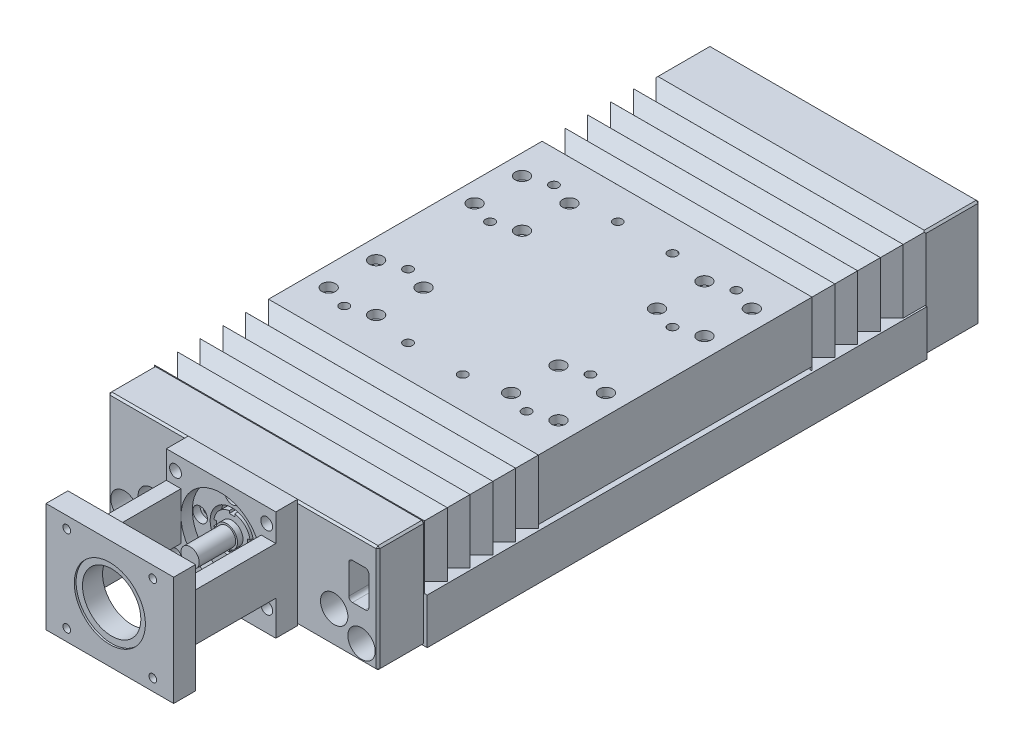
SolidWorks part; units mm, degrees
ref_plane "前视基准面" through (0, 0, 0) normal (0, 0, 1) x (1, 0, 0)
ref_plane "上视基准面" through (0, 0, 0) normal (0, 1, 0) x (1, 0, 0)
ref_plane "右视基准面" through (0, 0, 0) normal (1, 0, 0) x (0, 0, -1)
sketch "草图1" plane through (0, 0, 0) normal (0, 0, 1) x (1, 0, 0)
  line L0 (37.5, 30) -> (42.5, 30)
  line L1 (-75, 0) -> (75, 0)
  line L2 (-75, 0) -> (-75, 25)
  line L3 (-42.5, 30) -> (-37.5, 30)
  line L4 (75, 0) -> (75, 25)
  line L6 (-37.5, 30) -> (-37.5, 16)
  line L7 (-34.5, 13) -> (34.5, 13)
  line L8 (37.5, 30) -> (37.5, 16)
  line L10 (-42.5, 30) -> (-42.5, 28)
  line L11 (-42.5, 28) -> (-50, 28)
  line L12 (42.5, 30) -> (42.5, 28)
  line L13 (42.5, 28) -> (50, 28)
  line L14 (-50, 28) -> (-50, 25)
  line L15 (-50, 25) -> (-75, 25)
  line L18 (50, 28) -> (50, 25)
  line L19 (50, 25) -> (75, 25)
  arc A0 (37.5, 16) -> (34.5, 13) centre (34.5, 16) cw
  arc A1 (-37.5, 16) -> (-34.5, 13) centre (-34.5, 16) ccw
  point P0 (-75, 0)
  point P3 (75, 0)
  point P12 (37.5, 13)
  point P22 (-37.5, 13)
  dimension "D11" = 3
  dimension "D1" = 150
  dimension "D2" = 13
  dimension "D3" = 75
  dimension "D4" = 85
  dimension "D5" = 100
  dimension "D6" = 30
  dimension "D7" = 75
  dimension "D9" = 25
  dimension "D10" = 28
extrude "凸台-拉伸1" add sketch "草图1" along normal mid plane 274
ref_plane "基准面1" through (0, 0, 137) normal (0, 0, 1) x (1, 0, 0)
sketch "草图3" plane through (0, 0, 137) normal (0, 0, 1) x (1, 0, 0)
  line L1 (-74, 60) -> (74, 60)
  line L2 (-74, 60) -> (-74, 1)
  line L3 (-74, 1) -> (74, 1)
  line L4 (74, 60) -> (74, 1)
  dimension "D1" = 148
  dimension "D2" = 59
  dimension "D3" = 74
  dimension "D4" = 1
extrude "凸台-拉伸2" add sketch "草图3" along normal blind 26 separate body
ref_plane "基准面2" through (0, 0, -137) normal (0, 0, -1) x (-1, 0, 0)
sketch "草图4" plane through (0, 0, -137) normal (0, 0, -1) x (-1, 0, 0)
  line L1 (-74, 1) -> (74, 1)
  line L2 (-74, 1) -> (-74, 60)
  line L3 (-74, 60) -> (74, 60)
  line L4 (74, 1) -> (74, 60)
extrude "凸台-拉伸3" add sketch "草图4" along normal blind 30
sketch "草图5" plane through (0, 0, 163) normal (0, 0, 1) x (1, 0, 0)
  circle A0 centre (0, 33) radius 10
  dimension "D1" = 20
  dimension "D2" = 33
extrude "切除-拉伸1" cut sketch "草图5" against normal up to next
sketch "草图6" plane through (0, 0, 163) normal (0, 0, 1) x (1, 0, 0)
  circle A0 centre (0, 33) radius 14
  dimension "D1" = 28
extrude "切除-拉伸2" cut sketch "草图6" against normal blind 18
sketch "草图7" plane through (0, 0, -167) normal (0, 0, -1) x (-1, 0, 0)
  circle A0 centre (0, 33) radius 13
  dimension "D2" = 26
  dimension "D1" = 33
extrude "切除-拉伸3" cut sketch "草图7" against normal up to next
sketch "草图8" plane through (0, 0, 0) normal (0, 0, 1) x (1, 0, 0)
  line L0 (-20, 44) -> (-20, 24)
  line L1 (-74, 60) -> (74, 60)
  line L2 (-74, 60) -> (-74, 27)
  line L3 (-10, 14) -> (10, 14)
  line L4 (74, 60) -> (74, 27)
  line L5 (-20, 44) -> (-33, 44)
  line L6 (20, 44) -> (20, 33)
  line L7 (-33, 44) -> (-33, 52)
  line L8 (-33, 52) -> (-67, 52)
  line L9 (-67, 52) -> (-67, 44)
  line L10 (-67, 44) -> (-69, 44)
  line L11 (-69, 44) -> (-69, 27)
  line L12 (20, 33) -> (17, 33)
  line L13 (-69, 27) -> (-74, 27)
  line L14 (20, 44) -> (33, 44)
  line L15 (17, 33) -> (17, 21)
  line L16 (33, 44) -> (33, 52)
  line L17 (33, 52) -> (67, 52)
  line L18 (67, 52) -> (67, 44)
  line L19 (67, 44) -> (69, 44)
  line L20 (69, 44) -> (69, 27)
  line L21 (69, 27) -> (74, 27)
  line L22 (-20, 24) -> (-10, 14)
  line L23 (10, 14) -> (17, 21)
  circle A0 centre (0, 33) radius 10
  point P9 (-20, 14)
  point P12 (17, 14)
  dimension "D1" = 20
  dimension "D2" = 27
  dimension "D3" = 148
  dimension "D4" = 74
  dimension "D5" = 33
  dimension "D6" = 40
  dimension "D7" = 20
  dimension "D8" = 46
  dimension "D9" = 3
  dimension "D10" = 138
  dimension "D11" = 69
  dimension "D12" = 33
  dimension "D13" = 66
  dimension "D14" = 33
  dimension "D15" = 34
  dimension "D16" = 34
  dimension "D17" = 8
  dimension "D18" = 16
  dimension "D19" = 16
  dimension "D20" = 27
  dimension "D23" = 10
  dimension "D24" = 7
extrude "凸台-拉伸4" add sketch "草图8" along normal mid plane 150 separate body
sketch "草图9" plane through (0, 0, -75) normal (0, 0, -1) x (-1, 0, 0)
  line L1 (-33, 44) -> (30.2224, 44)
  line L2 (-33, 44) -> (-33, 7.4314)
  line L3 (-33, 7.4314) -> (30.2224, 7.4314)
  line L4 (30.2224, 44) -> (30.2224, 7.4314)
extrude "切除-拉伸4" cut sketch "草图9" against normal blind 60
sketch "草图10" plane through (0, 0, 75) normal (0, 0, 1) x (1, 0, 0)
  circle A0 centre (0, 33) radius 14
  dimension "D1" = 28
extrude "切除-拉伸5" cut sketch "草图10" against normal blind 50
hole_wizard "M6 螺纹孔1" positions "草图12" profile "草图11" tap size "M6" standard "GB"
sketch "草图12" plane through (0, 60, 0) normal (0, 1, 0) x (-1, 0, 0)
  point P0 (50, -57.5)
  point P1 (15, -57.5)
  point P3 (-15, -57.5)
  point P5 (-50, -57.5)
  point P7 (50, -22.5)
  point P9 (50, 22.5)
  point P11 (50, 57.5)
  point P17 (15, 57.5)
  point P23 (-15, 57.5)
  point P25 (-50, -22.5)
  point P27 (-50, 22.5)
  point P29 (-50, 57.5)
  dimension "D1" = 45
  dimension "D2" = 35
  dimension "D3" = 35
  dimension "D4" = 22.5
  dimension "D5" = 30
  dimension "D6" = 35
  dimension "D7" = 35
  dimension "D8" = 15
sketch "草图11" plane through (-50, 60, -57.5) normal (1, 0, 0) x (0, 0, 1)
  line L0 (0, 0) -> (0, 12.5022)
  line L1 (0, 12.5022) -> (2.5, 11)
  line L2 (2.5, 11) -> (2.5, 0)
  line L5 (2.5, 0) -> (0, 0)
  line L10 (0, 12.5022) -> (-2.5, 11) construction
  line L11 (0, -6.35) -> (0, 107.95) construction
  dimension "螺纹孔钻头直径" = 5
  dimension "螺纹孔钻头深度" = 11
  dimension "导头角度" = 118
hole_wizard "孔1" positions "草图15" profile "草图14" legacy
sketch "草图15" plane through (0, 60, 0) normal (0, 1, 0) x (-1, 0, 0)
  point P0 (-63, -53)
  point P1 (-63, -27)
  point P3 (-37, -53)
  point P5 (-37, -27)
  point P7 (-63, 27)
  point P9 (-63, 53)
  point P11 (-37, 27)
  point P13 (-37, 53)
  point P15 (63, 53)
  point P17 (63, 27)
  point P19 (37, 27)
  point P21 (37, 53)
  point P23 (63, -27)
  point P25 (63, -53)
  point P27 (37, -53)
  point P29 (37, -27)
  dimension "D1" = 26
  dimension "D2" = 26
  dimension "D3" = 26
  dimension "D4" = 26
  dimension "D5" = 54
  dimension "D6" = 27
  dimension "D7" = 74
  dimension "D8" = 37
sketch "草图14" plane through (63, 60, -53) normal (1, 0, 0) x (0, 0, 1)
  line L0 (0, 0) -> (0, 100)
  line L1 (0, 100) -> (2.25, 100)
  line L2 (2.25, 100) -> (2.25, 4.5)
  line L3 (2.25, 4.5) -> (3.75, 4.5)
  line L4 (3.75, 4.5) -> (3.75, 0)
  line L5 (3.75, 0) -> (0, 0)
  line L6 (0, 110) -> (0, -10) construction
  dimension "直径" = 4.5
  dimension "深度" = 100
  dimension "柱坑直径" = 7.5
  dimension "柱坑深度" = 4.5
ref_plane "基准面3" through (0, 33, 0) normal (0, 1, 0) x (-1, 0, 0)
sketch "草图17" plane through (0, 0, 163) normal (0, 0, 1) x (1, 0, 0)
  line L0 (58, 37) -> (69, 37) construction
  line L1 (60, 47) -> (67, 47)
  line L2 (58, 45) -> (58, 29)
  line L3 (60, 27) -> (67, 27)
  line L4 (69, 45) -> (69, 29)
  line L5 (-74, 1) -> (74, 1) construction
  line L6 (63.5, 47) -> (63.5, 27) construction
  arc A0 (69, 29) -> (67, 27) centre (67, 29) cw
  arc A1 (60, 27) -> (58, 29) centre (60, 29) cw
  arc A2 (58, 45) -> (60, 47) centre (60, 45) cw
  arc A3 (67, 47) -> (69, 45) centre (67, 45) cw
  point P14 (69, 27)
  point P17 (58, 27)
  point P22 (69, 47)
  dimension "D5" = 2
  dimension "D1" = 11
  dimension "D2" = 20
  dimension "D3" = 36
  dimension "D4" = 63.5
extrude "切除-拉伸6" cut sketch "草图17" against normal up to next
sketch "草图18" plane through (0, 0, 137) normal (0, 0, -1) x (-1, 0, 0)
  line L0 (-74, 1) -> (-74, 60) construction
  line L1 (-67, 47) -> (-34.5, 47)
  line L2 (-69, 45) -> (-69, 29)
  line L3 (-67, 27) -> (-34.5, 27)
  line L4 (-32.5, 45) -> (-32.5, 29)
  line L5 (-74, 60) -> (74, 60) construction
  arc A0 (-67, 27) -> (-69, 29) centre (-67, 29) cw
  arc A1 (-67, 47) -> (-69, 45) centre (-67, 45) ccw
  arc A2 (-34.5, 27) -> (-32.5, 29) centre (-34.5, 29) ccw
  arc A3 (-32.5, 45) -> (-34.5, 47) centre (-34.5, 45) ccw
  point P10 (-69, 27)
  point P13 (-69, 47)
  point P18 (-32.5, 47)
  dimension "D5" = 2
  dimension "D6" = 2
  dimension "D1" = 20
  dimension "D2" = 5
  dimension "D3" = 13
  dimension "D4" = 36.5
extrude "切除-拉伸7" cut sketch "草图18" against normal blind 10
hole_wizard "M6 螺纹孔2" positions "草图20" profile "草图19" tap size "M6" standard "GB"
sketch "草图20" plane through (0, 0, 163) normal (0, 0, 1) x (1, 0, 0)
  line L0 (-74, 1) -> (74, 1) construction
  point P0 (-25, 53)
  point P1 (25, 53)
  point P3 (-25, 13)
  point P5 (25, 13)
  dimension "D1" = 40
  dimension "D2" = 50
  dimension "D3" = 25
  dimension "D4" = 52
sketch "草图19" plane through (-25, 53, 163) normal (1, 0, 0) x (0, -1, 0)
  line L0 (0, 0) -> (0, 16.5022)
  line L1 (0, 16.5022) -> (2.5, 15)
  line L2 (2.5, 15) -> (2.5, 0)
  line L5 (2.5, 0) -> (0, 0)
  line L10 (0, 16.5022) -> (-2.5, 15) construction
  line L11 (0, -6.35) -> (0, 107.95) construction
  dimension "螺纹孔钻头直径" = 5
  dimension "螺纹孔钻头深度" = 15
  dimension "导头角度" = 118
chamfer "倒角1" distance 1 angle 45 12 edges at (0, 1, 137) (74, 30.5, 137) (74, 1, 150) (0, 1, 163) (74, 30.5, 163) (74, 60, 150) (0, 60, 137) (-74, 1, 150) (-74, 30.5, 137) (-74, 30.5, 163) (-74, 60, 150) (0, 60, 163)
hole_wizard "孔2" positions "草图23" profile "草图22" legacy
sketch "草图23" plane through (0, 0, 163) normal (0, 0, 1) x (1, 0, 0)
  line L0 (73, 1) -> (-73, 1) construction
  point P0 (-65, 10)
  point P1 (-50, 19)
  point P3 (50, 19)
  point P5 (65, 10)
  dimension "D1" = 130
  dimension "D2" = 65
  dimension "D3" = 100
  dimension "D4" = 50
  dimension "D5" = 9
  dimension "D6" = 18
sketch "草图22" plane through (-65, 10, 163) normal (1, 0, 0) x (0, -1, 0)
  line L0 (0, 0) -> (0, 100)
  line L1 (0, 100) -> (4.5, 100)
  line L2 (4.5, 100) -> (4.5, 16)
  line L3 (4.5, 16) -> (7.5, 16)
  line L4 (7.5, 16) -> (7.5, 0)
  line L5 (7.5, 0) -> (0, 0)
  line L6 (0, 110) -> (0, -10) construction
  dimension "直径" = 9
  dimension "深度" = 100
  dimension "柱坑直径" = 15
  dimension "柱坑深度" = 16
hole_wizard "孔3" positions "草图26" profile "草图25" legacy
sketch "草图26" plane through (0, 0, -167) normal (0, 0, -1) x (-1, 0, 0)
  line L0 (-74, 1) -> (74, 1) construction
  point P0 (-65, 10)
  point P1 (-50, 19)
  point P3 (65, 10)
  point P5 (50, 19)
  dimension "D1" = 100
  dimension "D2" = 130
  dimension "D3" = 50
  dimension "D4" = 65
  dimension "D5" = 9
  dimension "D6" = 18
sketch "草图25" plane through (65, 10, -167) normal (1, 0, 0) x (0, 1, 0)
  line L0 (0, 0) -> (0, 100)
  line L1 (0, 100) -> (4.5, 100)
  line L2 (4.5, 100) -> (4.5, 16)
  line L3 (4.5, 16) -> (7.5, 16)
  line L4 (7.5, 16) -> (7.5, 0)
  line L5 (7.5, 0) -> (0, 0)
  line L6 (0, 110) -> (0, -10) construction
  dimension "直径" = 9
  dimension "深度" = 100
  dimension "柱坑直径" = 15
  dimension "柱坑深度" = 16
sketch "草图28" plane through (0, 0, 163) normal (0, 0, 1) x (1, 0, 0)
  line L0 (82.5, 33) -> (-82.5, 33) construction
  line L1 (-30, 61) -> (30, 61)
  line L2 (-30, 61) -> (-30, 1)
  line L3 (-30, 1) -> (30, 1)
  line L4 (30, 61) -> (30, 1)
  circle A0 centre (0, 33) radius 22
  circle A1 centre (-25, 53) radius 3.25
  circle A2 centre (25, 53) radius 3.25
  circle A3 centre (25, 13) radius 3.25
  circle A4 centre (-25, 13) radius 3.25
  dimension "D5" = 44
  dimension "D6" = 6.5
  dimension "D1" = 60
  dimension "D2" = 60
  dimension "D3" = 28
  dimension "D4" = 30
extrude "凸台-拉伸5" add sketch "草图28" along normal blind 12
sketch "草图29" plane through (0, 0, 175) normal (0, 0, 1) x (1, 0, 0)
  line L0 (-30, 59) -> (-30, 2) construction
  line L1 (-30, 46) -> (-22, 46)
  line L2 (-30, 46) -> (-30, 20)
  line L3 (-30, 20) -> (-22, 20)
  line L4 (-22, 46) -> (-22, 20)
  line L5 (30, 1) -> (30, 61) construction
  line L6 (30, 46) -> (22, 46)
  line L7 (30, 46) -> (30, 20)
  line L8 (30, 20) -> (22, 20)
  line L9 (22, 46) -> (22, 20)
  line L10 (82.5, 33) -> (-82.5, 33) construction
  dimension "D1" = 26
  dimension "D2" = 13
  dimension "D3" = 8
  dimension "D4" = 8
extrude "凸台-拉伸6" add sketch "草图29" along normal blind 49
sketch "草图30" plane through (0, 0, 224) normal (0, 0, 1) x (1, 0, 0)
  line L0 (82.5, 33) -> (-82.5, 33) construction
  line L1 (-35, 63) -> (35, 63)
  line L2 (-35, 63) -> (-35, 3)
  line L3 (-35, 3) -> (35, 3)
  line L4 (35, 63) -> (35, 3)
  circle A0 centre (0, 33) radius 16
  dimension "D5" = 32
  dimension "D1" = 60
  dimension "D2" = 30
  dimension "D3" = 70
  dimension "D4" = 35
extrude "凸台-拉伸7" add sketch "草图30" along normal blind 12
hole_wizard "M5 螺纹孔1" positions "草图32" profile "草图31" tap size "M5" standard "GB"
sketch "草图32" plane through (0, 0, 236) normal (0, 0, 1) x (1, 0, 0)
  line L0 (82.5, 33) -> (-82.5, 33) construction
  point P0 (-23.6, 56.6)
  point P1 (-23.6, 9.4)
  point P3 (23.6, 9.4)
  point P5 (23.6, 56.6)
  dimension "D1" = 47.2
  dimension "D2" = 47.2
  dimension "D3" = 23.6
  dimension "D4" = 23.6
sketch "草图31" plane through (-23.6, 56.6, 236) normal (1, 0, 0) x (0, -1, 0)
  line L0 (0, 0) -> (0, 13.6618)
  line L1 (0, 13.6618) -> (2.1, 12.4)
  line L2 (2.1, 12.4) -> (2.1, 0)
  line L5 (2.1, 0) -> (0, 0)
  line L10 (0, 13.6618) -> (-2.1, 12.4) construction
  line L11 (0, -6.35) -> (0, 107.95) construction
  dimension "螺纹孔钻头直径" = 4.2
  dimension "螺纹孔钻头深度" = 12.4
  dimension "导头角度" = 118
sketch "草图33" plane through (0, 0, 236) normal (0, 0, 1) x (1, 0, 0)
  circle A0 centre (0, 33) radius 19.5
  dimension "D1" = 39
extrude "切除-拉伸8" cut sketch "草图33" against normal blind 1
sketch "草图34" plane through (0, 0, 0) normal (0, 0, 1) x (1, 0, 0)
  line L1 (-50, 25) -> (-65, 25)
  line L2 (-50, 25) -> (-50, 40)
  line L3 (-50, 40) -> (-65, 40)
  line L4 (-65, 25) -> (-65, 40)
  line L5 (50, 25) -> (65, 25)
  line L6 (50, 25) -> (50, 40)
  line L7 (50, 40) -> (65, 40)
  line L8 (65, 25) -> (65, 40)
  dimension "D1" = 15
  dimension "D2" = 15
  dimension "D3" = 15
extrude "凸台-拉伸8" add sketch "草图34" against normal up to surface (137 mm away) separate body
mirror "镜向2" about plane through (0, 0, 0) normal (0, 0, 1) of "凸台-拉伸8"
sketch "草图35" plane through (0, 0, 0) normal (1, 0, 0) x (0, 0, -1)
  line L0 (75, 60) -> (81.25, 53.7545)
  line L1 (81.25, 53.7545) -> (87.5, 60.0091)
  line L2 (75, 60) -> (75, 59)
  line L3 (75, 27) -> (75, 60) construction
  line L4 (75, 59) -> (81.25, 52.7545)
  line L5 (81.25, 52.7545) -> (87.5, 59.0091)
  line L6 (87.5, 59.0091) -> (87.5, 60.0091)
  dimension "D1" = 12.5
  dimension "D2" = 1
  dimension "D3" = 6.2545
  dimension "D4" = 7.2455
extrude "凸台-拉伸9" add sketch "草图35" along normal mid plane 148
sketch "草图36" plane through (0, 60, 0) normal (0, 1, 0) x (1, 0, 0)
  line L0 (-74, 75) -> (-67.75, 81.25)
  line L1 (74, 81.25) -> (-74, 81.25) construction
  line L2 (-67.75, 81.25) -> (-74, 87.5)
  line L3 (-74, 87.5) -> (-74, 75)
  line L4 (74, 87.5) -> (67.75, 81.25)
  line L5 (67.75, 81.25) -> (74, 75)
  line L6 (74, 87.5) -> (74, 75)
  dimension "D1" = 90
  dimension "D2" = 90
extrude "切除-拉伸9" cut sketch "草图36" against normal up to next
sketch "草图37" plane through (0, 60, 0) normal (0, 1, 0) x (1, 0, 0)
  line L0 (-74, 75) -> (-67.75, 81.25)
  line L1 (-67.75, 81.25) -> (-74, 87.5)
  line L2 (-74, 87.5) -> (-73, 87.5)
  line L3 (74, 87.5) -> (-74, 87.5) construction
  line L4 (-73, 87.5) -> (-66.75, 81.25)
  line L5 (67.75, 81.25) -> (-67.75, 81.25) construction
  line L6 (-66.75, 81.25) -> (-73, 75)
  line L7 (74, 75) -> (-74, 75) construction
  line L8 (-73, 75) -> (-74, 75)
  line L9 (74, 75) -> (67.75, 81.25)
  line L10 (67.75, 81.25) -> (74, 87.5)
  line L11 (74, 87.5) -> (73, 87.5)
  line L12 (73, 87.5) -> (66.75, 81.25)
  line L13 (66.75, 81.25) -> (73, 75)
  line L14 (73, 75) -> (74, 75)
  dimension "D1" = 1
  dimension "D2" = 1
extrude "凸台-拉伸10" add sketch "草图37" against normal up to surface (35 mm away)
sketch "草图38" plane through (0, 0, 0) normal (1, 0, 0) x (0, 0, -1)
  line L0 (75, 60) -> (81.25, 53.7545)
  line L1 (81.25, 25) -> (81.25, 60) construction
  line L2 (81.25, 53.7545) -> (87.4909, 60)
  line L3 (75, 60) -> (87.4909, 60)
extrude "切除-拉伸10" cut sketch "草图38" against normal mid plane 148
pattern_linear "阵列(线性)1" count 5 spacing 12.5 along (0, 0, -1) of "切除-拉伸10", "凸台-拉伸10", "切除-拉伸9", "凸台-拉伸9"
mirror "镜向3" about plane through (0, 0, 0) normal (0, 0, 1) of "凸台-拉伸9", "切除-拉伸9", "凸台-拉伸10", "切除-拉伸10", "阵列(线性)1"
sketch "草图39" plane through (0, 33, 0) normal (0, 1, 0) x (-1, 0, 0)
  line L0 (0, 305.5936) -> (0, -249.1557) construction
  line L1 (8, 145) -> (8, -139)
  line L2 (8, -139) -> (5, -139)
  line L3 (5, -139) -> (5, -166)
  line L4 (5, -166) -> (0, -166)
  line L5 (8, 145) -> (6, 145)
  line L6 (6, 145) -> (6, 172)
  line L7 (5, 192) -> (0, 192)
  line L8 (-75, -137) -> (-74, -137) construction
  line L9 (33.005, 137) -> (-33.005, 137) construction
  line L10 (0, 192) -> (0, -166)
  line L12 (5, 192) -> (5, 172)
  line L13 (5, 172) -> (6, 172)
  dimension "D1" = 8
  dimension "D2" = 47
  dimension "D3" = 5
  dimension "D4" = 2
  dimension "D5" = 8
  dimension "D6" = 6
  dimension "D7" = 27
  dimension "D8" = 5
  dimension "D9" = 27
revolve "旋转1" add sketch "草图39" angle 360 about L0
sketch "草图40" plane through (0, 0, 163) normal (0, 0, 1) x (1, 0, 0)
  circle A0 centre (0, 33) radius 21.75
  circle A1 centre (0, 33) radius 12
  dimension "D1" = 43.5
  dimension "D2" = 24
extrude "凸台-拉伸11" add sketch "草图40" along normal blind 6
hole_wizard "孔4" positions "草图42" profile "草图41" legacy
sketch "草图42" plane through (0, 0, 169) normal (0, 0, 1) x (1, 0, 0)
  circle A0 centre (0, 33) radius 17.5 construction
  point P0 (-17.5, 33)
  point P6 (0, 50.5)
  point P8 (17.5, 33)
  point P10 (0, 15.5)
  dimension "D1" = 35
sketch "草图41" plane through (-17.5, 33, 169) normal (1, 0, 0) x (0, -1, 0)
  line L0 (0, 0) -> (0, 6)
  line L1 (0, 6) -> (2.25, 6)
  line L2 (2.25, 6) -> (2.25, 4)
  line L3 (2.25, 4) -> (4, 4)
  line L4 (4, 4) -> (4, 0)
  line L5 (4, 0) -> (0, 0)
  line L6 (0, 110) -> (0, -10) construction
  dimension "直径" = 4.5
  dimension "深度" = 6
  dimension "柱坑直径" = 8
  dimension "柱坑深度" = 4
sketch "草图43" plane through (0, 0, 169) normal (0, 0, 1) x (1, 0, 0)
  line L0 (82.5, 33) -> (-82.5, 33) construction
  line L2 (-1.5, 42.8869) -> (-1.5, 41.5)
  line L3 (-1.5, 41.5) -> (1.5, 41.5)
  line L4 (1.5, 42.8869) -> (1.5, 41.5)
  line L7 (-9.8869, 34.5) -> (-8.5, 34.5)
  line L9 (-9.8869, 31.5) -> (-8.5, 31.5)
  line L10 (-8.5, 34.5) -> (-8.5, 31.5)
  line L11 (8.5, 34.5) -> (9.8869, 34.5)
  line L12 (8.5, 34.5) -> (8.5, 31.5)
  line L13 (8.5, 31.5) -> (9.8869, 31.5)
  line L15 (-1.5, 24.5) -> (1.5, 24.5)
  line L16 (-1.5, 24.5) -> (-1.5, 23.1131)
  line L18 (1.5, 24.5) -> (1.5, 23.1131)
  arc A0 (-1.5, 42.8869) -> (-9.8869, 34.5) centre (0, 33) ccw
  arc A1 (1.5, 23.1131) -> (9.8869, 31.5) centre (0, 33) ccw
  arc A2 (-9.8869, 31.5) -> (-1.5, 23.1131) centre (0, 33) ccw
  arc A3 (9.8869, 34.5) -> (1.5, 42.8869) centre (0, 33) ccw
  circle A4 centre (0, 33) radius 6
  dimension "D1" = 20
  dimension "D2" = 8.5
  dimension "D4" = 1.5
  dimension "D5" = 8.5
  dimension "D6" = 1.5
  dimension "D7" = 1.5
  dimension "D8" = 17
  dimension "D9" = 8.5
  dimension "D10" = 1.5
extrude "凸台-拉伸12" add sketch "草图43" against normal blind 8
chamfer "倒角2" distance 1 angle 45 8 edges at (0, 1, -167) (74, 1, -152.25) (74, 30.5, -167) (74, 60, -152.25) (-74, 1, -152.25) (0, 60, -167) (-74, 60, -152.25) (-74, 30.5, -167)
sketch "草图44" plane through (0, 0, 137) normal (0, 0, 1) x (1, 0, 0)
  line L0 (-30, 1) -> (30, 1) construction
  line L1 (-30, -3.1097) -> (30, -3.1097)
  line L2 (-30, -3.1097) -> (-30, 1)
  line L3 (-30, 1) -> (30, 1)
  line L4 (30, -3.1097) -> (30, 1)
  line L5 (0, 0) -> (0, -3.1097) construction
  dimension "D1" = 60
extrude "切除-拉伸11" cut sketch "草图44" against normal through all
